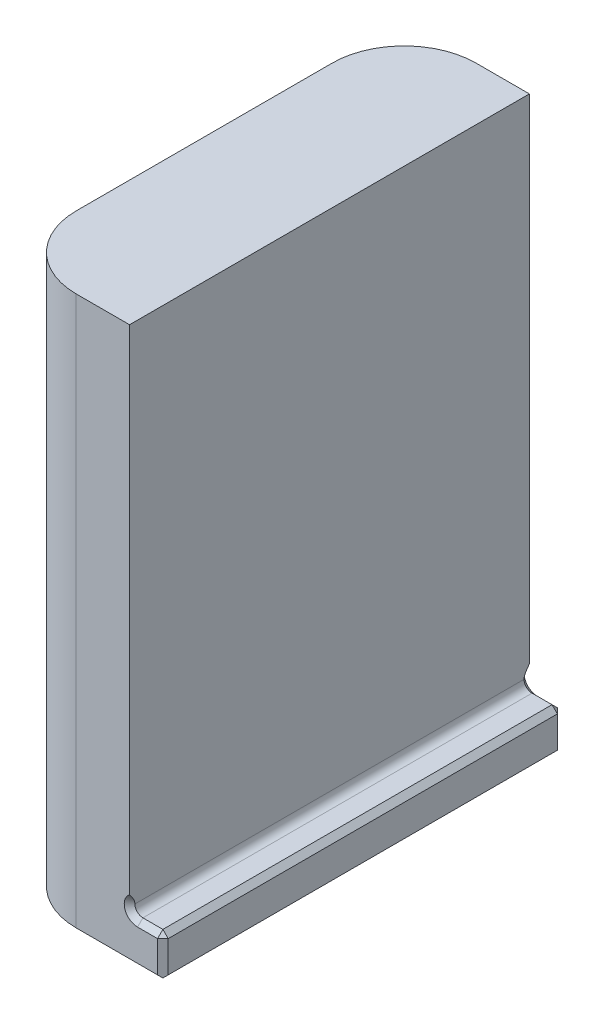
SolidWorks part; units mm, degrees
ref_plane "Front Plane" through (0, 0, 0) normal (0, 0, 1) x (1, 0, 0)
ref_plane "Top Plane" through (0, 0, 0) normal (0, 1, 0) x (1, 0, 0)
ref_plane "Right Plane" through (0, 0, 0) normal (1, 0, 0) x (0, 0, -1)
sketch "Sketch1" plane through (0, 0, 0) normal (0, 0, 1) x (1, 0, 0)
  line L0 (0, 0) -> (0, -26.924)
  line L1 (0, -26.924) -> (7.5565, -26.924)
  line L2 (7.5565, -26.924) -> (7.5565, -24.4094)
  line L3 (7.5565, -24.4094) -> (6.35, -24.4094)
  line L4 (5.969, -24.0284) -> (5.969, 0)
  line L5 (5.969, 0) -> (0, 0)
  arc A0 (6.35, -24.4094) -> (5.969, -24.0284) centre (6.35, -24.0284) cw
  dimension "D5" = 0.381
  dimension "D1" = 5.969
  dimension "D2" = 26.924
  dimension "D3" = 7.5565
  dimension "D4" = 2.5146
extrude "Boss-Extrude1" add sketch "Sketch1" along normal mid plane 19.05
fillet "Fillet1" radius 3.429 2 edges at (0, -13.462, -9.525) (0, -13.462, 9.525)
chamfer "Chamfer1" distance 0.762 angle 45 6 edges at (5.4928, -26.924, -9.525) (1.0043, -26.924, -8.5207) (0, -26.924, 0) (1.0043, -26.924, 8.5207) (7.5565, -26.924, 0) (5.4928, -26.924, 9.525)
chamfer "Chamfer2" distance 0.254 angle 45 5 edges at (7.5565, -25.2857, -9.525) (6.9533, -24.4094, -9.525) (7.5565, -25.2857, 9.525) (6.9533, -24.4094, 9.525) (7.5565, -24.4094, 0)
